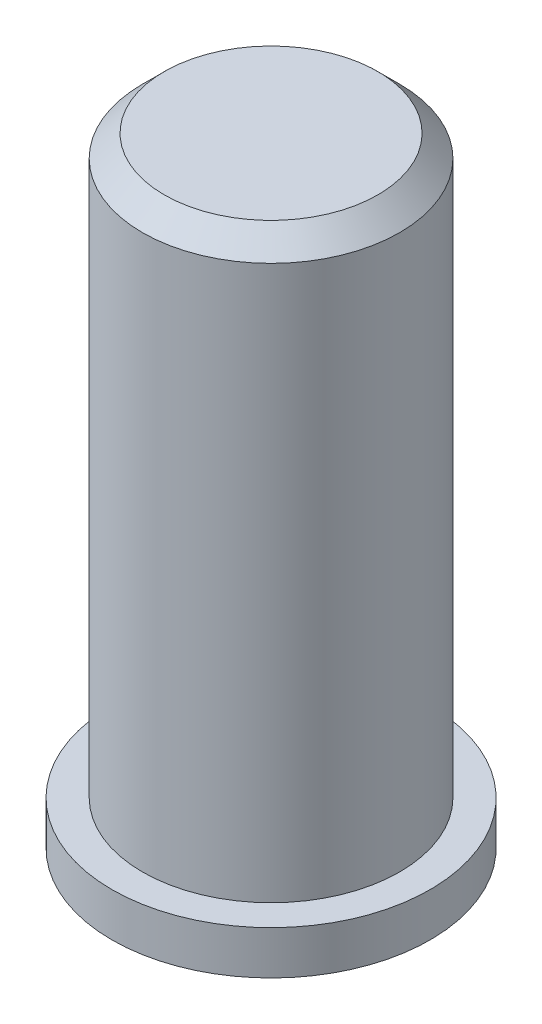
SolidWorks part; units mm, degrees
ref_plane "Piano frontale" through (0, 0, 0) normal (0, 0, 1) x (1, 0, 0)
ref_plane "Piano superiore" through (0, 0, 0) normal (0, 1, 0) x (1, 0, 0)
ref_plane "Piano destro" through (0, 0, 0) normal (1, 0, 0) x (0, 0, -1)
sketch "Schizzo1" plane through (0, 0, 0) normal (0, 0, 1) x (1, 0, 0)
  line L0 (0, 0) -> (0, -0.5)
  line L1 (0, -0.5) -> (0.4, -0.5)
  line L2 (0.4, -0.5) -> (0.4, 0)
  line L3 (0.4, 0) -> (3.65, 0)
  line L4 (3.65, 0) -> (3.65, 1)
  line L5 (3.65, 1) -> (2.95, 1)
  line L6 (2.95, 1) -> (2.95, 13.7)
  line L7 (2.45, 14.2) -> (0, 14.2)
  line L8 (0, 14.2) -> (0, 0)
  line L9 (2.45, 14.2) -> (2.95, 13.7)
  dimension "D1" = 0.7
  dimension "D2" = 0.5
  dimension "D3" = 0.5
  dimension "D4" = 14.2
  dimension "D5" = 1
  dimension "D6" = 3.65
  dimension "D7" = 0.5
  dimension "D8" = 0.4
revolve "Rivoluzione1" add sketch "Schizzo1" angle 360 about L8
sketch "Schizzo2" plane through (0, -0.5, 0) normal (0, -1, 0) x (1, 0, 0)
  point P0 (0, 0)
